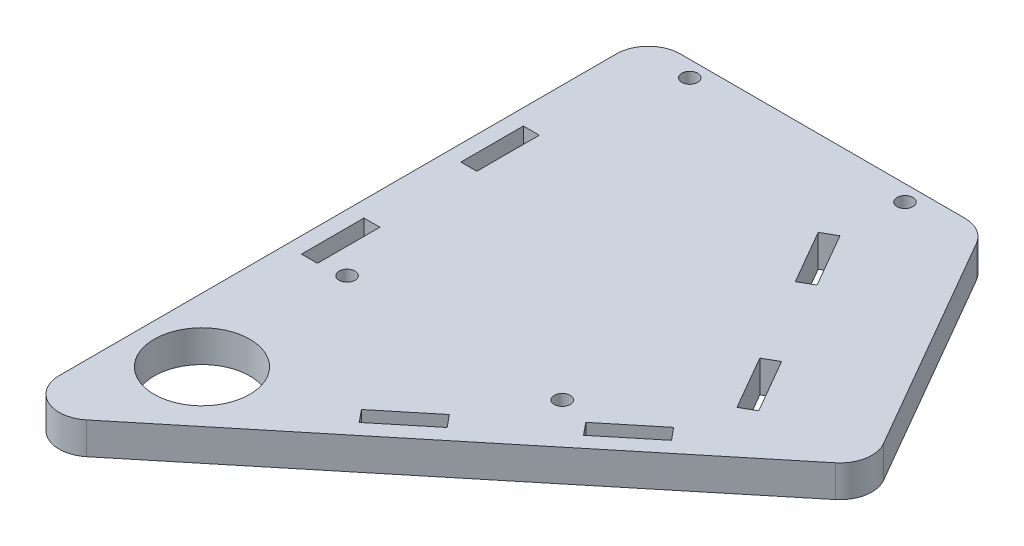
SolidWorks part; units mm, degrees
ref_plane "Front" through (0, 0, 0) normal (0, 0, 1) x (1, 0, 0)
ref_plane "Top" through (0, 0, 0) normal (0, 1, 0) x (1, 0, 0)
ref_plane "Right" through (0, 0, 0) normal (1, 0, 0) x (0, 0, -1)
sketch "Sketch1" plane through (0, 0, 0) normal (0, 1, 0) x (1, 0, 0)
  line L0 (-130.6265, 191.8892) -> (-142.0248, 182.5473)
  line L1 (-152.4, 187.4585) -> (-152.4, 298.45)
  line L2 (-98.1075, 301.625) -> (-140.97, 301.625) construction
  line L3 (-140.97, 301.625) -> (-140.97, 233.3625) construction
  line L4 (-58.5756, 257.8194) -> (-83.8668, 301.625)
  line L5 (-60.0496, 249.7331) -> (-130.6265, 191.8892)
  line L6 (-140.97, 233.3625) -> (-98.1075, 233.3625) construction
  line L7 (-98.1075, 233.3625) -> (-98.1075, 301.625) construction
  line L20 (-146.05, 304.8) -> (-89.366, 304.8)
  line L40 (-149.225, 276.7424) -> (-146.05, 276.7424)
  line L41 (-149.225, 276.7424) -> (-149.225, 264.2964)
  line L42 (-149.225, 264.2964) -> (-146.05, 264.2964)
  line L43 (-146.05, 276.7424) -> (-146.05, 264.2964)
  line L46 (-117.708, 304.8) -> (-117.708, 202.477) construction
  line L57 (-146.05, 232.5464) -> (-146.05, 244.9924)
  line L58 (-149.225, 244.9924) -> (-146.05, 244.9924)
  line L59 (-149.225, 232.5464) -> (-149.225, 244.9924)
  line L60 (-149.225, 232.5464) -> (-146.05, 232.5464)
  line L80 (-101.5176, 287.7471) -> (-98.768, 289.3346)
  line L81 (-101.5176, 287.7471) -> (-95.2946, 276.9686)
  line L82 (-95.2946, 276.9686) -> (-92.545, 278.5561)
  line L83 (-98.768, 289.3346) -> (-92.545, 278.5561)
  line L84 (-76.67, 251.0597) -> (-82.893, 261.8383)
  line L85 (-85.6426, 260.2508) -> (-82.893, 261.8383)
  line L86 (-79.4196, 249.4722) -> (-85.6426, 260.2508)
  line L87 (-79.4196, 249.4722) -> (-76.67, 251.0597)
  line L88 (-71.2212, 279.7222) -> (43230.049, 25279.7222) construction
  line L89 (-93.3255, 218.3555) -> (31601.1101, -38452.858) construction
  line L90 (-82.2722, 239.7301) -> (-80.2596, 237.2744)
  line L91 (-82.2722, 239.7301) -> (-91.8982, 231.8407)
  line L92 (-91.8982, 231.8407) -> (-89.8856, 229.3851)
  line L93 (-80.2596, 237.2744) -> (-89.8856, 229.3851)
  line L94 (-93.9198, 277.7623) -> (-84.2678, 261.0446) construction
  line L95 (-147.6375, 264.2964) -> (-147.6375, 244.9924) construction
  line L97 (-114.4418, 209.2591) -> (-104.8158, 217.1485)
  line L98 (-106.8284, 219.6041) -> (-104.8158, 217.1485)
  line L99 (-116.4544, 211.7147) -> (-106.8284, 219.6041)
  line L100 (-116.4544, 211.7147) -> (-114.4418, 209.2591)
  line L101 (-90.8919, 230.6129) -> (-105.8221, 218.3763) construction
  line L102 (-64.0748, 254.6444) -> (-50064.0748, 254.6444) construction
  line L103 (-149.225, 270.5194) -> (-152.4, 270.5194) construction
  line L104 (-95.6565, 283.9453) -> (-79.1587, 293.4703) construction
  line L105 (-85.0726, 233.3297) -> (-83.06, 230.8741) construction
  arc A0 (-152.4, 187.4585) -> (-142.0248, 182.5473) centre (-146.05, 187.4585) ccw
  circle A1 centre (-140.97, 301.625) radius 1.5875
  circle A2 centre (-140.97, 233.3625) radius 1.5875
  circle A3 centre (-98.1075, 301.625) radius 1.5875
  circle A4 centre (-98.1075, 233.3625) radius 1.5875
  circle A5 centre (-139.7, 203.2) radius 9.525
  arc A10 (-58.5756, 257.8194) -> (-60.0496, 249.7331) centre (-64.0748, 254.6444) cw
  arc A12 (-152.4, 298.45) -> (-146.05, 304.8) centre (-146.05, 298.45) cw
  arc A17 (-89.366, 304.8) -> (-83.8668, 301.625) centre (-89.366, 298.45) cw
  point P17 (-55.88, 253.1505)
  point P166 (-71.2212, 279.7222)
  point P169 (-95.3381, 220.8111)
  point P170 (-147.6375, 254.6444)
  point P176 (-89.0938, 269.4034)
  point P191 (-98.357, 224.4946)
  dimension "D1" = 30
  dimension "D8" = 3.175
  dimension "D9" = 19.304
  dimension "D11" = 3.175
  dimension "D12" = 68.2625
  dimension "D13" = 42.8625
  dimension "D15" = 11.43
  dimension "D16" = 19.05
  dimension "D24" = 6.35
  dimension "D6" = 6.35
  dimension "D10" = 12.446
  dimension "D4" = 50.662
  dimension "D5" = 56.684
  dimension "D7" = 110.9915
  dimension "D14" = 3.175
  dimension "D17" = 12.7
  dimension "D18" = 101.6
  dimension "D19" = 19.05
  dimension "D33" = 3.175
extrude "Extrude1" add sketch "Sketch1" along normal blind 6.35
